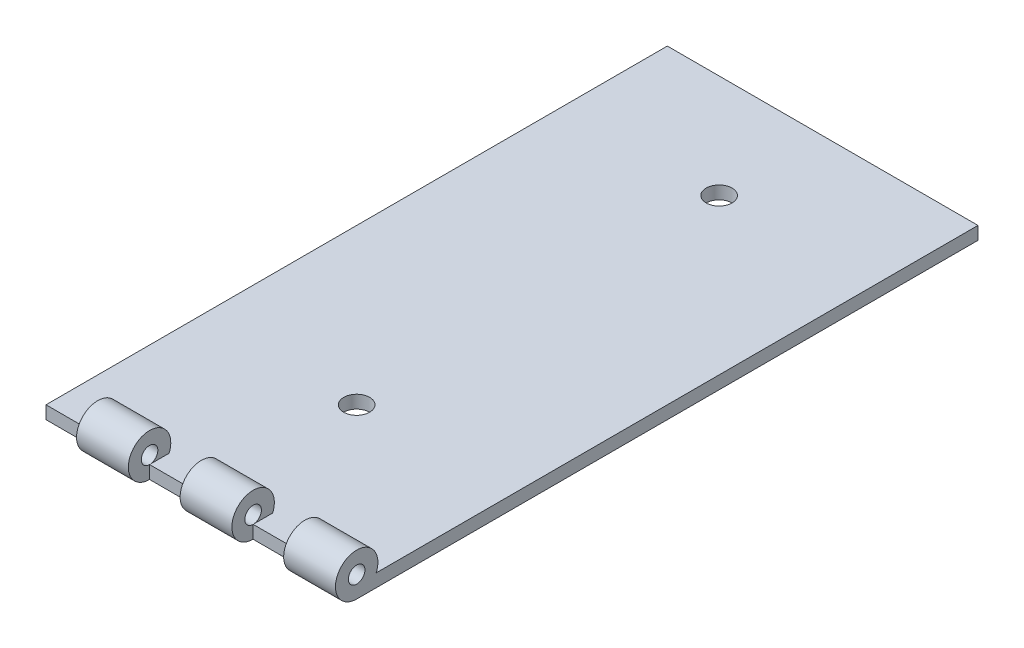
SolidWorks part; units mm, degrees
ref_plane "Front Plane" through (0, 0, 0) normal (0, 0, 1) x (1, 0, 0)
ref_plane "Top Plane" through (0, 0, 0) normal (0, 1, 0) x (1, 0, 0)
ref_plane "Right Plane" through (0, 0, 0) normal (1, 0, 0) x (0, 0, -1)
sketch "Sketch1" plane through (0, 0, 0) normal (0, 1, 0) x (1, 0, 0)
  line L1 (-19.05, -38.1) -> (19.05, -38.1)
  line L2 (-19.05, -38.1) -> (-19.05, 38.1)
  line L3 (-19.05, 38.1) -> (19.05, 38.1)
  line L4 (19.05, -38.1) -> (19.05, 38.1)
  line L5 (-19.05, -38.1) -> (19.05, 38.1) construction
  line L6 (-19.05, 38.1) -> (19.05, -38.1) construction
  point P0 (0, 0)
  dimension "D1" = 76.2
  dimension "D2" = 38.1
extrude "Boss-Extrude1" add sketch "Sketch1" along normal blind 1.5875
sketch "Sketch2" plane through (19.05, 0, 0) normal (1, 0, 0) x (0, 0, -1)
  circle A0 centre (-38.1, 2.6035) radius 1.016
  circle A1 centre (-38.1, 2.6035) radius 2.6035
extrude "Boss-Extrude2" add sketch "Sketch2" against normal blind 6.35
sketch "Sketch3" plane through (0, 1.5875, 0) normal (0, 1, 0) x (1, 0, 0)
  line L0 (23.6109, -39.2348) -> (-22.4212, -39.2348) construction
pattern_linear "LPattern1" count 3 spacing 12.7 along (-1, 0, 0) of "Boss-Extrude2"
sketch "Sketch5" plane through (0, 1.5875, 0) normal (0, 1, 0) x (1, 0, 0)
  line L0 (0, -27.1548) -> (0, 32.6046) construction
  circle A0 centre (0, 25.4) radius 1.5875
  circle A1 centre (0, -19.05) radius 1.5875
  dimension "D1" = 25.4
  dimension "D2" = 19.05
extrude "Cut-Extrude1" cut sketch "Sketch5" against normal through all both and the other way through all
